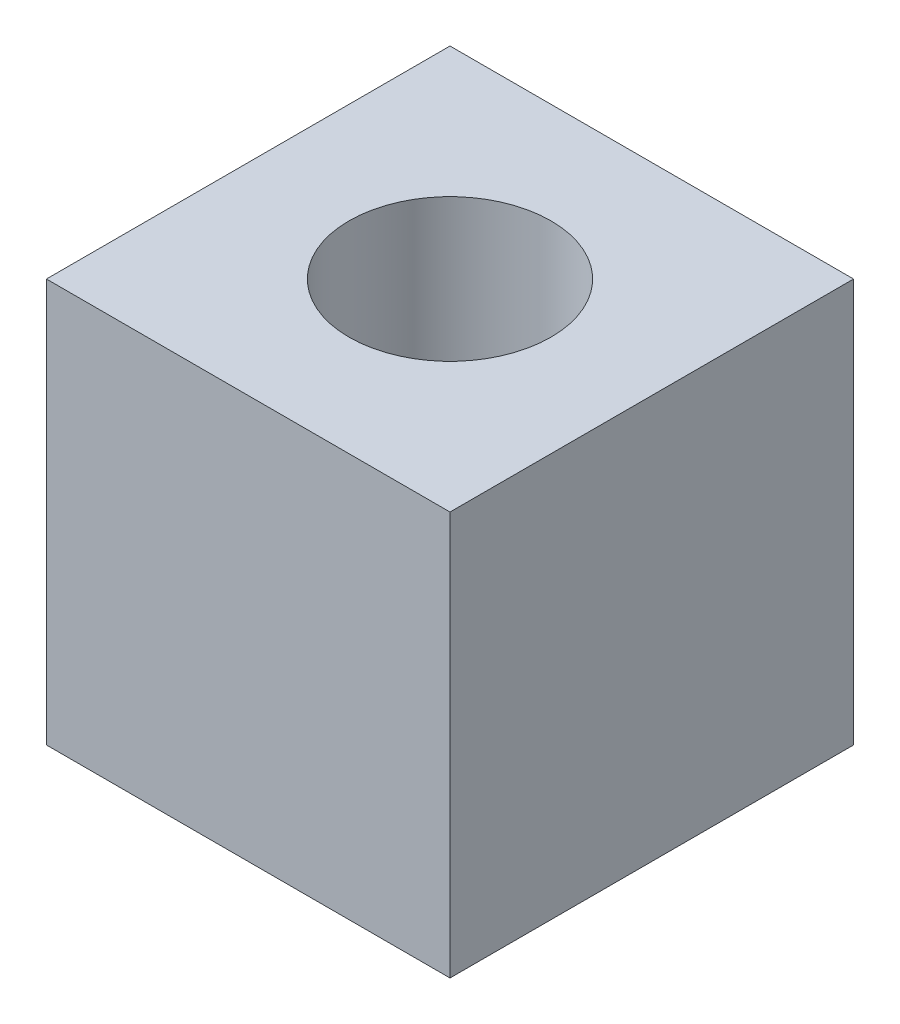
SolidWorks part; units mm, degrees
ref_plane "Front" through (0, 0, 0) normal (0, 0, 1) x (1, 0, 0)
ref_plane "Top" through (0, 0, 0) normal (0, 1, 0) x (1, 0, 0)
ref_plane "Right" through (0, 0, 0) normal (1, 0, 0) x (0, 0, -1)
sketch "Sketch1" plane through (0, 0, 0) normal (0, 0, 1) x (1, 0, 0)
  line L1 (0, 0) -> (101.6, 0)
  line L2 (0, 0) -> (0, 101.6)
  line L3 (0, 101.6) -> (101.6, 101.6)
  line L4 (101.6, 0) -> (101.6, 101.6)
  dimension "D1" = 101.6
extrude "Extrude1" add sketch "Sketch1" along normal blind 101.6
sketch "Sketch2" plane through (0, 101.6, 0) normal (0, 1, 0) x (-1, 0, 0)
  line L0 (0, 101.6) -> (-101.6, 0) construction
  circle A0 centre (-50.8, 50.8) radius 25.4
  dimension "D1" = 50.8
extrude "Cut-Extrude1" cut sketch "Sketch2" against normal through all
